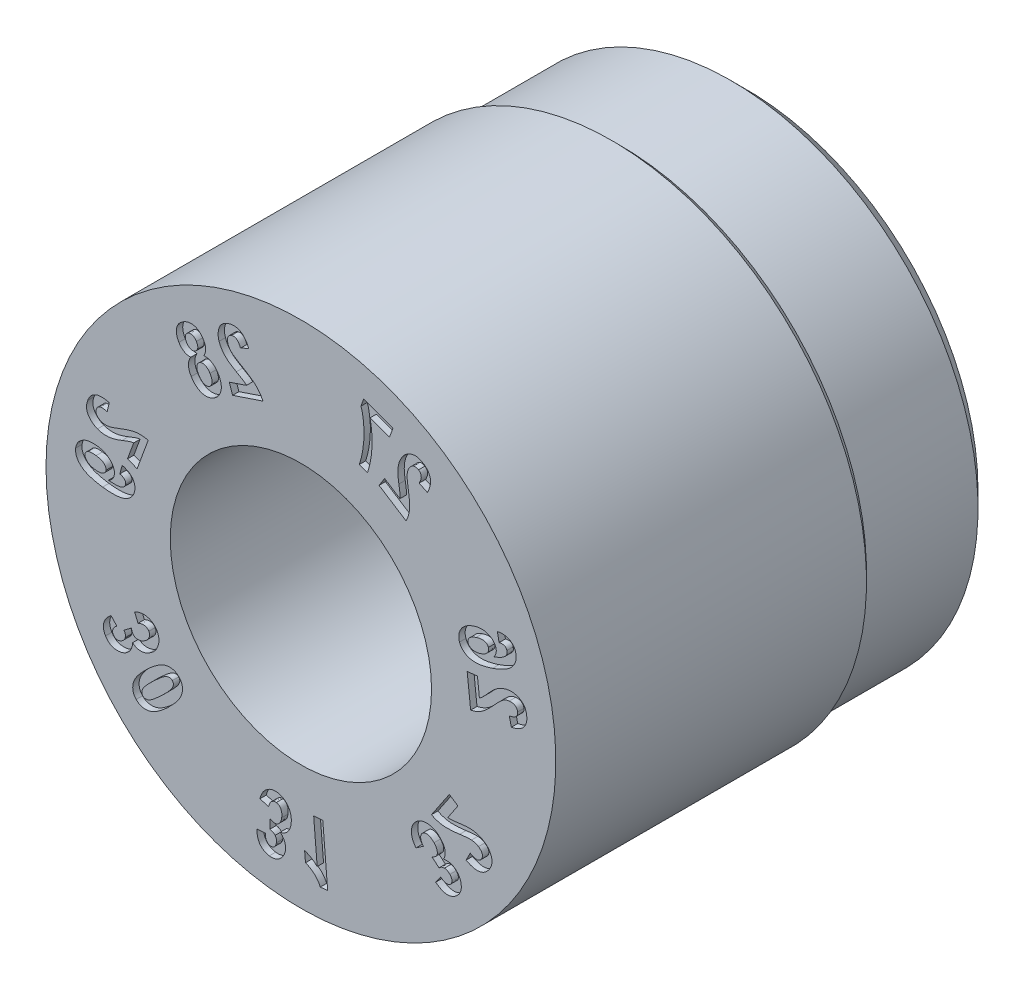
SolidWorks part; units mm, degrees
ref_plane "Front Plane" through (0, 0, 0) normal (0, 0, 1) x (1, 0, 0)
ref_plane "Top Plane" through (0, 0, 0) normal (0, 1, 0) x (1, 0, 0)
ref_plane "Right Plane" through (0, 0, 0) normal (1, 0, 0) x (0, 0, -1)
sketch "Sketch2" plane through (0, 0, 0) normal (0, 1, 0) x (1, 0, 0)
  line L0 (0, 4.8491) -> (0, -49995.1509) construction
  line L10 (7.2496, 14) -> (2, 14)
  line L11 (7.75, 13.4996) -> (7.2496, 14)
  line L12 (7.75, 10) -> (7.75, 13.4996)
  line L13 (8, 9.75) -> (7.75, 10)
  line L14 (8, 0) -> (8, 9.75)
  line L15 (4.1, 0) -> (8, 0)
  line L16 (4.1, 0) -> (4.1, 10)
  line L17 (2, 10) -> (4.1, 10)
  line L18 (2, 10) -> (2, 14)
  dimension "D1" = 16
  dimension "D2" = 8.2
  dimension "D3" = 4
  dimension "D4" = 4
  dimension "D5" = 15.5
  dimension "D6" = 14
  dimension "D7" = 45
  dimension "D8" = 45
  dimension "D9" = 4
  dimension "D10" = 0.5004
revolve "Revolve1" add sketch "Sketch2" angle 360 about L0
sketch "Sketch9" plane through (0, 0, 0) normal (0, 0, 1) x (1, 0, 0)
  circle A30 centre (0, 0) radius 5.3324 construction
  text T0 "26    27    28    29    30    31    32" font "Arial Narrow" height 1.82
extrude "Cut-Extrude3" cut sketch "Sketch9" against normal blind 0.2
